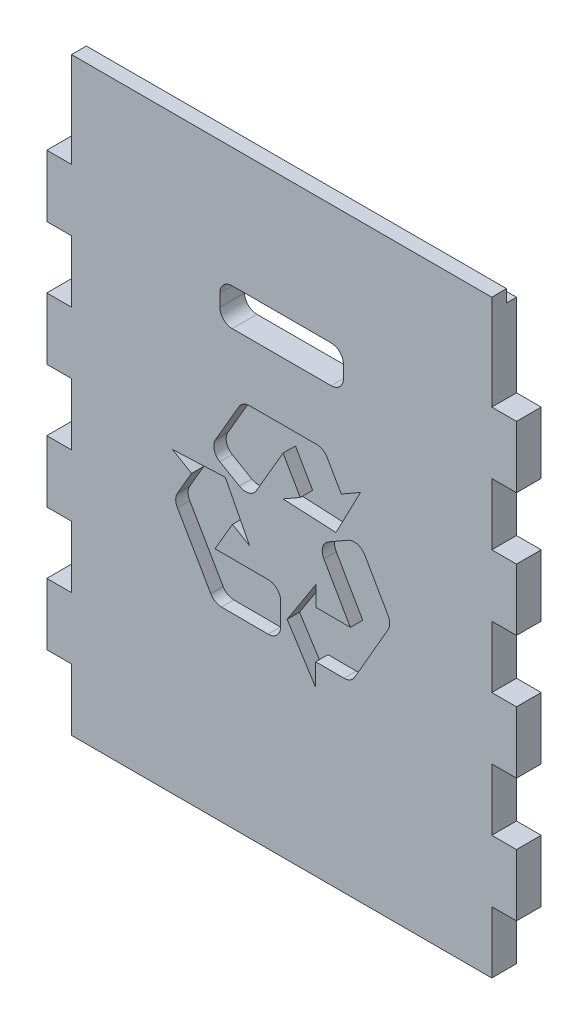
SolidWorks part; units mm, degrees
ref_plane "Front" through (0, 0, 0) normal (0, 0, 1) x (1, 0, 0)
ref_plane "Top" through (0, 0, 0) normal (0, 1, 0) x (1, 0, 0)
ref_plane "Right" through (0, 0, 0) normal (1, 0, 0) x (0, 0, -1)
sketch "Sketch1" plane through (0, 0, 0) normal (0, 0, 1) x (1, 0, 0)
  line L0 (0, 50) -> (20, 50)
  line L1 (20, 0) -> (360, 0)
  line L2 (0, 50) -> (0, 100)
  line L3 (20, 477) -> (360, 477)
  line L4 (380, 50) -> (380, 100)
  line L5 (0, 100) -> (20, 100)
  line L6 (0, 150) -> (20, 150)
  line L7 (0, 200) -> (20, 200)
  line L8 (0, 250) -> (20, 250)
  line L9 (0, 300) -> (20, 300)
  line L10 (0, 350) -> (20, 350)
  line L11 (0, 400) -> (20, 400)
  line L12 (360, 477) -> (360, 400)
  line L13 (20, 0) -> (20, 50)
  line L14 (20, 100) -> (20, 150)
  line L15 (0, 150) -> (0, 200)
  line L16 (20, 200) -> (20, 250)
  line L17 (0, 250) -> (0, 300)
  line L18 (20, 300) -> (20, 350)
  line L19 (0, 350) -> (0, 400)
  line L20 (20, 400) -> (20, 477)
  line L21 (360, 350) -> (380, 350)
  line L22 (360, 400) -> (380, 400)
  line L23 (360, 300) -> (380, 300)
  line L24 (360, 250) -> (380, 250)
  line L25 (360, 200) -> (380, 200)
  line L26 (360, 150) -> (380, 150)
  line L27 (360, 100) -> (380, 100)
  line L28 (360, 50) -> (380, 50)
  line L29 (360, 50) -> (360, 0)
  line L30 (380, 150) -> (380, 200)
  line L31 (360, 150) -> (360, 100)
  line L32 (380, 250) -> (380, 300)
  line L33 (360, 250) -> (360, 200)
  line L34 (380, 350) -> (380, 400)
  line L35 (360, 350) -> (360, 300)
  dimension "D1" = 477
  dimension "D3" = 20
  dimension "D4" = 20
extrude "Extrude1" add sketch "Sketch1" along normal blind 20
sketch "Sketch2" plane through (0, 0, 20) normal (0, 0, 1) x (1, 0, 0)
  line L0 (190, 494.8097) -> (190, 44.8097) construction
  line L1 (150, 380) -> (230, 380)
  line L2 (140, 370) -> (140, 360)
  line L3 (150, 350) -> (230, 350)
  line L4 (240, 370) -> (240, 360)
  line L5 (360, 477) -> (20, 477) construction
  line L6 (380, 350) -> (380, 400) construction
  arc A0 (150, 380) -> (140, 370) centre (150, 370) ccw
  arc A1 (150, 350) -> (140, 360) centre (150, 360) cw
  arc A2 (240, 360) -> (230, 350) centre (230, 360) cw
  arc A3 (230, 380) -> (240, 370) centre (230, 370) cw
  dimension "D2" = 10
  dimension "D1" = 50
  dimension "D3" = 127
  dimension "D4" = 190
  dimension "D5" = 97
  dimension "D6" = 100
extrude "Extrude2" cut sketch "Sketch2" against normal through all
sketch "Sketch3" plane through (0, 0, 20) normal (0, 0, 1) x (1, 0, 0)
  line L0 (164.1171, 303.0282) -> (218.2138, 303.0282)
  line L1 (194.4718, 168.558) -> (217.7332, 204.5731)
  line L2 (191.1855, 283.3999) -> (169.5175, 246.1586)
  line L3 (217.4913, 132.3877) -> (194.4718, 168.558)
  line L4 (217.5514, 150.3154) -> (240.3662, 150.239)
  line L5 (155.4736, 298.0572) -> (136.4662, 265.3887)
  line L6 (217.5514, 150.3154) -> (217.4913, 132.3877)
  line L7 (191.1525, 251.2313) -> (205.0525, 259.1945)
  line L8 (253.7879, 287.1146) -> (233.9733, 249.0939)
  line L9 (233.9733, 249.0939) -> (191.1525, 251.2313)
  line L10 (238.2319, 278.2027) -> (253.7879, 287.1146)
  line L11 (205.0525, 259.1945) -> (191.1855, 283.3999)
  line L12 (238.2319, 278.2027) -> (226.8908, 297.9991)
  line L13 (140.0807, 251.7163) -> (155.8451, 242.5441)
  line L14 (217.6796, 188.5538) -> (245.5755, 188.4603)
  line L15 (217.7332, 204.5731) -> (217.6796, 188.5538)
  line L16 (245.5755, 188.4603) -> (224.1576, 225.846)
  line L17 (243.6891, 248.5602) -> (227.8636, 239.4939)
  line L18 (276.125, 212.059) -> (257.337, 244.8542)
  line L19 (276.1083, 202.0881) -> (249.06, 155.2389)
  line L20 (144.4764, 243.0352) -> (164.0357, 204.8826)
  line L21 (101.6422, 241.1849) -> (144.4764, 243.0352)
  line L22 (117.1381, 232.169) -> (105.6644, 212.449)
  line L23 (117.1381, 232.169) -> (101.6422, 241.1849)
  line L24 (150.1893, 212.9388) -> (136.1604, 188.827)
  line L25 (164.0357, 204.8826) -> (150.1893, 212.9388)
  line L26 (136.1604, 188.827) -> (179.2463, 188.6826)
  line L27 (189.1516, 160.4107) -> (189.2128, 178.6491)
  line L28 (141.3227, 150.5709) -> (179.1182, 150.4442)
  line L29 (132.696, 155.5709) -> (105.6476, 202.42)
  arc A0 (224.1576, 225.846) -> (227.8636, 239.4939) centre (232.8346, 230.8169) cw
  arc A1 (164.1171, 303.0282) -> (155.4736, 298.0572) centre (164.1171, 293.0282) ccw
  arc A2 (218.2138, 303.0282) -> (226.8908, 297.9991) centre (218.2138, 293.0282) cw
  arc A3 (136.4662, 265.3887) -> (140.0807, 251.7163) centre (145.1097, 260.3597) ccw
  arc A4 (169.5175, 246.1586) -> (155.8451, 242.5441) centre (160.874, 251.1876) cw
  arc A6 (257.337, 244.8542) -> (243.6891, 248.5602) centre (248.6601, 239.8832) ccw
  arc A7 (276.1083, 202.0881) -> (276.125, 212.059) centre (267.4481, 207.0881) ccw
  arc A8 (249.06, 155.2389) -> (240.3662, 150.239) centre (240.3997, 160.2389) cw
  arc A9 (179.2463, 188.6826) -> (189.2128, 178.6491) centre (179.2128, 178.6826) cw
  arc A10 (179.1182, 150.4442) -> (189.1516, 160.4107) centre (179.1517, 160.4442) ccw
  arc A11 (132.696, 155.5709) -> (141.3227, 150.5709) centre (141.3562, 160.5709) ccw
  arc A12 (105.6476, 202.42) -> (105.6644, 212.449) centre (114.3079, 207.42) cw
  dimension "D1" = 10
  dimension "D2" = 10
extrude "Extrude3" cut sketch "Sketch3" against normal blind 10
sketch "Sketch4" plane through (0, 0, 0) normal (0, 0, -1) x (-1, 0, 0)
  line L0 (-20, 477) -> (-20, 400) construction
  line L1 (-360, 477) -> (-20, 477)
  line L2 (-360, 477) -> (-360, 467)
  line L3 (-360, 467) -> (-20, 467)
  line L4 (-20, 477) -> (-20, 467)
  dimension "D1" = 10
extrude "Extrude4" cut sketch "Sketch4" against normal blind 8
